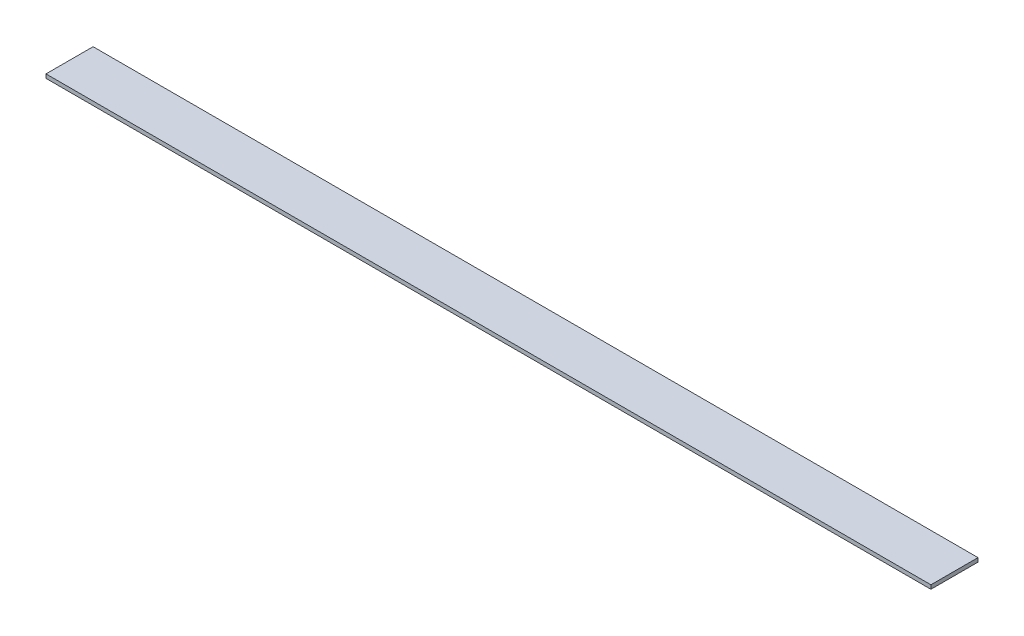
SolidWorks part; units mm, degrees
ref_plane "FRONT" through (0, 0, 0) normal (0, 0, 1) x (1, 0, 0)
ref_plane "TOP" through (0, 0, 0) normal (0, 1, 0) x (1, 0, 0)
ref_plane "RIGHT" through (0, 0, 0) normal (1, 0, 0) x (0, 0, -1)
sketch "Sketch1" plane through (0, 0, 0) normal (0, 1, 0) x (1, 0, 0)
  line L1 (-715.9625, 38.1) -> (715.9625, 38.1)
  line L2 (-715.9625, 38.1) -> (-715.9625, -38.1)
  line L3 (-715.9625, -38.1) -> (715.9625, -38.1)
  line L4 (715.9625, 38.1) -> (715.9625, -38.1)
  line L5 (-715.9625, 38.1) -> (715.9625, -38.1) construction
  line L6 (-715.9625, -38.1) -> (715.9625, 38.1) construction
  point P0 (0, 0)
  dimension "D1" = 1431.925
  dimension "D2" = 76.2
extrude "Boss-Extrude1" add sketch "Sketch1" along normal blind 6.35
